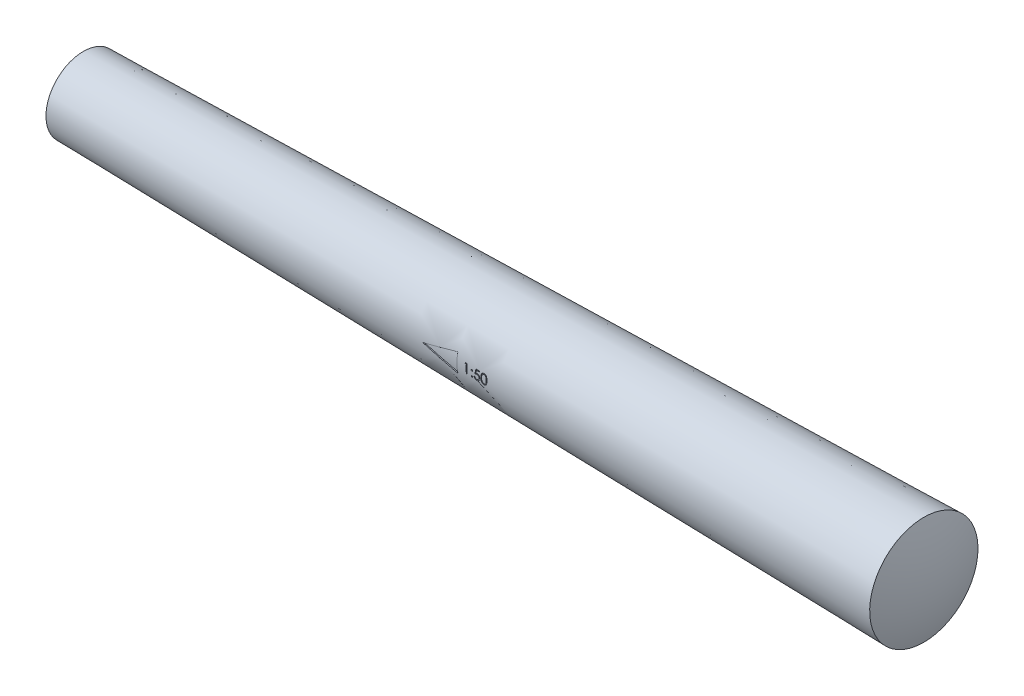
SolidWorks part; units mm, degrees
ref_plane "Front Plane" through (0, 0, 0) normal (0, 0, 1) x (1, 0, 0)
ref_plane "Top Plane" through (0, 0, 0) normal (0, 1, 0) x (1, 0, 0)
ref_plane "Right Plane" through (0, 0, 0) normal (1, 0, 0) x (0, 0, -1)
sketch "Sketch1" plane through (0, 0, 0) normal (1, 0, 0) x (0, 0, -1)
  circle A0 centre (0, 0) radius 4
  dimension "D1" = 8
extrude "Extrude1" add sketch "Sketch1" along normal mid plane 90
draft "Draft1" type of draft neutral plane draft angle 1.146 faces to draft 1 parameters "D1"=1.146
sketch "Sketch2" plane through (0, 0, 0) normal (0, 0, 1) x (1, 0, 0)
  line L0 (-45, 0) -> (-45, 4)
  line L1 (-45, 4) -> (-45, -4) construction
  line L2 (-45, 0) -> (-46, 0)
  line L3 (-46, 0) -> (-46, -4.9) construction
  line L4 (45, 0) -> (45, 5.8001)
  line L5 (45, -5.8001) -> (45, 5.8001) construction
  line L6 (45, 0) -> (46, 0)
  line L7 (46, 0) -> (46, -4.9) construction
  line L8 (-45, -4) -> (45, -5.8001) construction
  arc A0 (-46, 0) -> (-45, 4) centre (-37.5, 0) cw
  arc A1 (46, 0) -> (45, 5.8001) centre (28.6797, 0) ccw
  point P14 (0, -4.9)
revolve "Revolve1" add sketch "Sketch2" angle 360 about L2
sketch "Sketch5" plane through (0, 0, 0) normal (0, 0, 1) x (1, 0, 0)
  line L0 (0, 4.9) -> (0, -4.9) construction
  line L1 (45, 5.8001) -> (-45, 4) construction
  line L2 (-45, -4) -> (45, -5.8001) construction
ref_plane "Plane2" through (0, 0, 0) normal (-0.02, 0, 0.9998) x (0.9998, 0, 0.02)
sketch "Sketch6" plane through (0, 0, 0) normal (-0.02, 0, 0.9998) x (0.9998, 0, 0.02)
  line L0 (0, 0) -> (0, 1)
  line L1 (0, 4.9) -> (0, -4.9) construction
  line L2 (0, 1) -> (-3.7321, 0)
  line L3 (-3.7321, 0) -> (0, -1)
  line L4 (0, -1) -> (0, 0)
  line L5 (0, -0.5) -> (4, -0.5) construction
  text T0 "1:50" font "Century Gothic" height 1
  dimension "D1" = 2
  dimension "D2" = 30
  dimension "D3" = 4
wrap "Wrap2" sketch "Sketch6" wrap type deboss source sketch "Sketch6" thickness 0.1 parameters "D1"=0.1
equation "\"D2@Sketch2\" = \"D1@Sketch2\""
